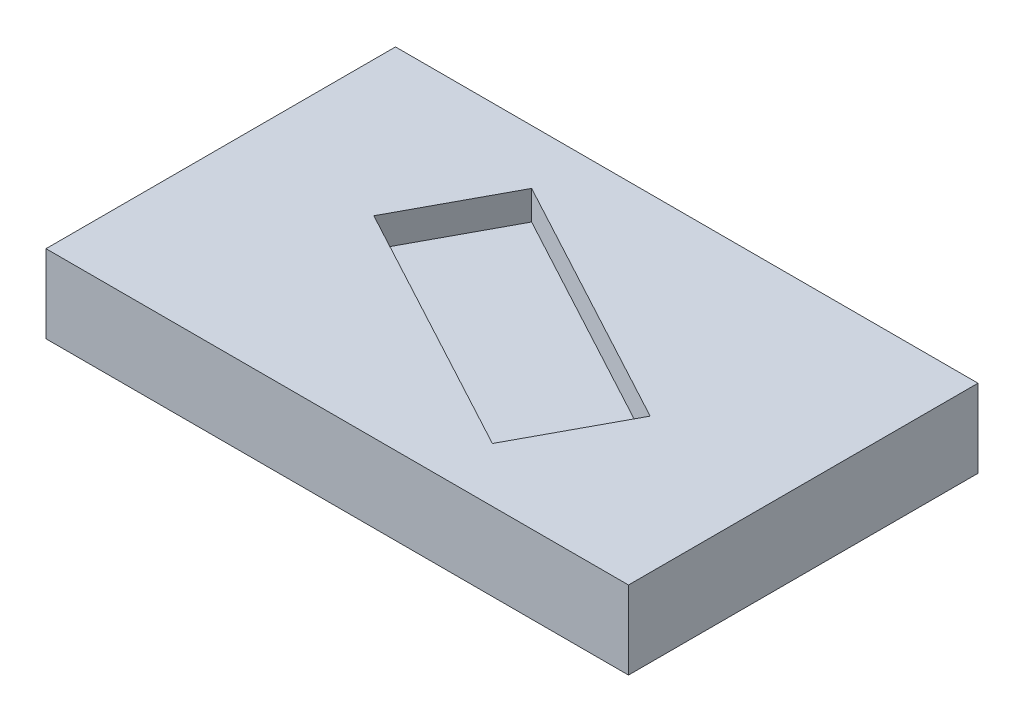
SolidWorks part; units mm, degrees
ref_plane "Front Plane" through (0, 0, 0) normal (0, 0, 1) x (1, 0, 0)
ref_plane "Top Plane" through (0, 0, 0) normal (0, 1, 0) x (1, 0, 0)
ref_plane "Right Plane" through (0, 0, 0) normal (1, 0, 0) x (0, 0, -1)
sketch "Sketch1" plane through (0, 0, 0) normal (0, 1, 0) x (1, 0, 0)
  line L0 (-63.5, -38.1) -> (63.5, 38.1) construction
  line L1 (-63.5, 38.1) -> (63.5, 38.1)
  line L2 (-63.5, 38.1) -> (-63.5, -38.1)
  line L3 (-63.5, -38.1) -> (63.5, -38.1)
  line L4 (63.5, 38.1) -> (63.5, -38.1)
  dimension "D1" = 127
  dimension "D2" = 76.2
extrude "Extrude1" add sketch "Sketch1" along normal blind 17.018
sketch "Sketch2" plane through (0, 17.018, 0) normal (0, 1, 0) x (-1, 0, 0)
  line L0 (21.9464, -26.2242) -> (-33.9779, 3.8545)
  line L1 (-33.9779, 3.8545) -> (-21.9464, 26.2242)
  line L2 (-21.9464, 26.2242) -> (33.9779, -3.8545)
  line L3 (33.9779, -3.8545) -> (21.9464, -26.2242)
  line L4 (-33.9779, 3.8545) -> (33.9779, -3.8545) construction
  dimension "D1" = 25.4
  dimension "D2" = 63.5
extrude "Cut-Extrude1" cut sketch "Sketch2" against normal blind 6.35
